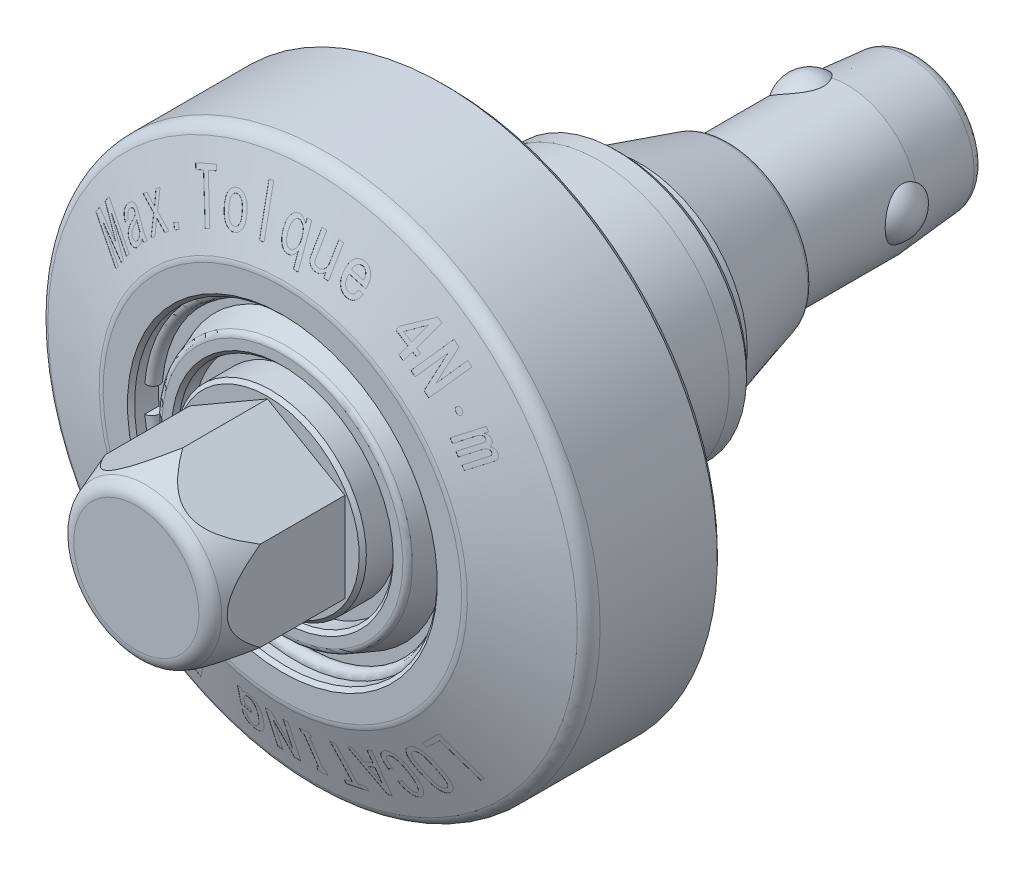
SolidWorks part; units mm, degrees
ref_plane "Front" through (0, 0, 0) normal (0, 0, 1) x (1, 0, 0)
ref_plane "Top" through (0, 0, 0) normal (0, 1, 0) x (1, 0, 0)
ref_plane "Right" through (0, 0, 0) normal (1, 0, 0) x (0, 0, -1)
imported_body "Imported1"
sketch "Sketch1" plane through (0, 0, 0) normal (1, 0, 0) x (0, 0, -1)
  line L0 (-34.9695, 0) -> (45.4547, 0) construction
  line L1 (-11.4666, 22.2104) -> (-12.7079, 18.8) construction
  line L2 (-11.7892, 21.3241) -> (-13.7831, 15.8459)
  line L3 (-13.7831, 15.8459) -> (-12.8425, 15.5035)
  line L4 (-13.3631, 17) -> (-13.9276, 15.4488) construction
  line L5 (-12.8425, 15.5035) -> (-10.8486, 20.9818)
  line L6 (-10.8486, 20.9818) -> (-11.7892, 21.3241)
revolve "Revolve1" add sketch "Sketch1" angle 147 mid plane about L0
sketch "Sketch2" plane through (0, 0, 14) normal (0, 0, 1) x (1, 0, 0)
  arc A0 (17, 0) -> (-17, 0) centre (0, 0) ccw construction
  text T0 "Max.Tolque 4N･m" font "ＭＳ ゴシック" height in points 12
extrude "Extrude1" cut sketch "Sketch2" against normal offset from surface (1.5316 mm away) 0.01
